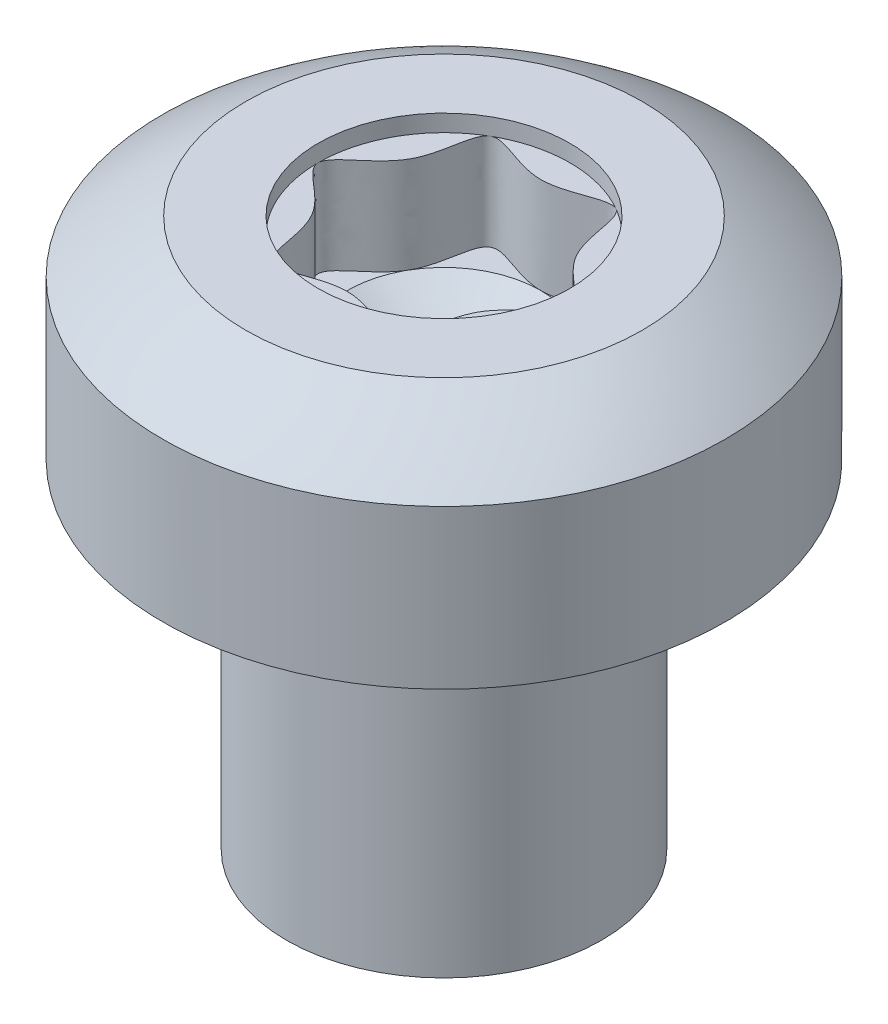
SolidWorks part; units mm, degrees
ref_plane "Front" through (0, 0, 0) normal (0, 0, 1) x (1, 0, 0)
ref_plane "Top" through (0, 0, 0) normal (0, 1, 0) x (1, 0, 0)
ref_plane "Right" through (0, 0, 0) normal (1, 0, 0) x (0, 0, -1)
sketch "Sketch1" plane through (0, 0, 0) normal (0, 0, 1) x (1, 0, 0)
  line L0 (0, 0) -> (0, 34.6184) construction
  line L1 (0, 0) -> (5.6, 0)
  line L2 (5.6, 0) -> (5.6, 12)
  line L3 (5.6, 12) -> (10, 12)
  line L4 (10, 12) -> (10, 19.5)
  line L5 (10, 19.5) -> (0, 19.5)
  line L6 (0, 19.5) -> (0, 0)
  line L7 (10, 12) -> (11.5, 12) construction
  line L8 (11.5, 12) -> (11.5, 3) construction
revolve "BODY" add sketch "Sketch1" angle 360 about L0
sketch "Sketch2" plane through (0, 0, 0) normal (0, 0, 1) x (1, 0, 0)
  line L0 (10, 17.625) -> (0, 5.135) construction
  line L3 (10, 12) -> (10, 19.5) construction
  line L4 (0, 0) -> (0, 34.6184) construction
  line L5 (0, 21.135) -> (0, 21.6172)
  line L6 (16, 5.135) -> (16, 21.6172)
  line L7 (16, 21.6172) -> (0, 21.6172)
  line L8 (0, 21.6172) -> (16, 21.6172)
  arc A0 (16, 5.135) -> (0, 21.135) centre (0, 5.135) ccw
revolve "HEAD-CUT" cut sketch "Sketch2" angle 360 about axis through (0, 0, 0) along (0, 1, 0)
sketch "Sketch4" plane through (0, 0, 0) normal (0, 0, 1) x (1, 0, 0)
  line L0 (-5.6, 9) -> (-5.3668, 11.6)
  line L1 (-5.6, 12) -> (-5.6, 0) construction
  line L2 (-5.6, 12) -> (-5.6, 9)
  arc A0 (-5.3668, 11.6) -> (-5.6, 12) centre (-5.7652, 11.6357) ccw
revolve "GAP" cut sketch "Sketch4" angle 360 about axis through (0, 0, 0) along (0, 1, 0)
sketch "Sketch5" plane through (0, 19.5, 0) normal (0, 1, 0) x (-1, 0, 0)
  line L0 (0, 3.4423) -> (0, 0) construction
  line L1 (0, 0) -> (2.2375, 3.8755) construction
  line L2 (2.2375, 3.8755) -> (-2.2375, 3.8755) construction
  line L3 (-2.2375, 3.8755) -> (-4.475, 0) construction
  line L4 (-4.475, 0) -> (-2.2375, -3.8755) construction
  line L5 (-2.2375, -3.8755) -> (2.2375, -3.8755) construction
  line L6 (2.2375, -3.8755) -> (4.475, 0) construction
  line L7 (4.475, 0) -> (2.2375, 3.8755) construction
  line L8 (0, 3.4423) -> (-2.9811, 1.7212) construction
  line L9 (-2.9811, 1.7212) -> (-2.9811, -1.7212) construction
  line L10 (-2.9811, -1.7212) -> (0, -3.4423) construction
  line L11 (0, -3.4423) -> (2.9811, -1.7212) construction
  line L12 (2.9811, -1.7212) -> (2.9811, 1.7212) construction
  line L13 (2.9811, 1.7212) -> (0, 3.4423) construction
  circle A0 centre (0, 0) radius 3.4423 construction
  circle A1 centre (0, 0) radius 4.475
  spline S0 degree 3 poles (2.7549, 4.7716) (0, 2.7777) (-2.7549, 4.7716) (-2.4055, 1.3888) (-5.5097, 0) (-2.4055, -1.3888) (-2.7549, -4.7716) (0, -2.7777) (2.7549, -4.7716) (2.4055, -1.3888) (5.5097, 0) (2.4055, 1.3888) (2.7549, 4.7716) (0, 2.7777) (-2.7549, 4.7716) knots -0.25 -0.166667 -0.083333 0 0.083333 0.166667 0.25 0.333333 0.416667 0.5 0.583333 0.666667 0.75 0.833333 0.916667 1 1.083333 1.166667 1.25 only from (0, 3.4423) to (0, 3.4423)
extrude "Recess-Cut-Extrude1" cut sketch "Sketch5" against normal blind 4.02
sketch "Sketch3" plane through (0, 0, 0) normal (0, 0, 1) x (1, 0, 0)
  line L0 (0, 13.4926) -> (3.4423, 15.48)
  line L1 (0, 0) -> (0, 34.6184) construction
  line L2 (3.4423, 15.48) -> (0, 15.48)
  line L3 (0, 15.48) -> (0, 13.4926)
revolve "DRILL-CUT" cut sketch "Sketch3" angle 360 about axis through (0, 0, 0) along (0, 1, 0)
sketch "Sketch6" plane through (0, 0, 0) normal (0, 0, 1) x (1, 0, 0)
  line L0 (5.6, 0) -> (4.7881, 0.4687)
  line L1 (4.7881, 0.4687) -> (5.6, 0.9375)
  line L4 (5.6, 0.9375) -> (5.6, 0)
  line L5 (0, 0) -> (0, 34.6184) construction
revolve "ThreadSchematic" [suppressed] cut sketch "Sketch6" angle 360 about axis through (0, 0, 0) along (0, 1, 0)
pattern_linear "ThdSchPat" [suppressed] count 6 spacing 1.5 along (0, 1, 0)
sketch "Sketch7" plane through (0, 19.5, 0) normal (0, 1, 0) x (-1, 0, 0)
  circle A0 centre (0, 0) radius 4.475
extrude "Recess-Cut-Extrude2" cut sketch "Sketch7" against normal blind 0.603
equation "\"D1@Sketch2\" = \"HEAD_HT@Sketch1\" * 0.25"
equation "\"D1@Sketch4\" = \"CONER_RAD@Sketch4\""
equation "\"D1@Recess-Cut-Extrude1\" = \"SLOT_DEP@Sketch3\""
equation "\"D1@Sketch7\" = \"slot_dia@Sketch5\""
equation "\"D1@Recess-Cut-Extrude2\" = \"SLOT_DEP@Sketch3\" * 0.15"
equation "\"D3@Sketch5\" = \"slot_dia@Sketch5\" / 1.3"
equation "\"DRILL_RAD@Sketch3\" = \"D3@Sketch5\" * 0.5"
equation "\"D1@ThreadCosmetic\" = \"thread_length@Sketch1\""
equation "\"D2@ThreadCosmetic\" = \"DIA@Sketch1\" - 1.0825 * \"pitch@Sketch1\""
equation "\"D1@Sketch6\" = \"D2@ThreadCosmetic\" / 2"
equation "\"D3@ThdSchPat\" = \"pitch@Sketch1\""
equation "\"D1@ThdSchPat\" = \"thread_length@Sketch1\" / \"pitch@Sketch1\""
